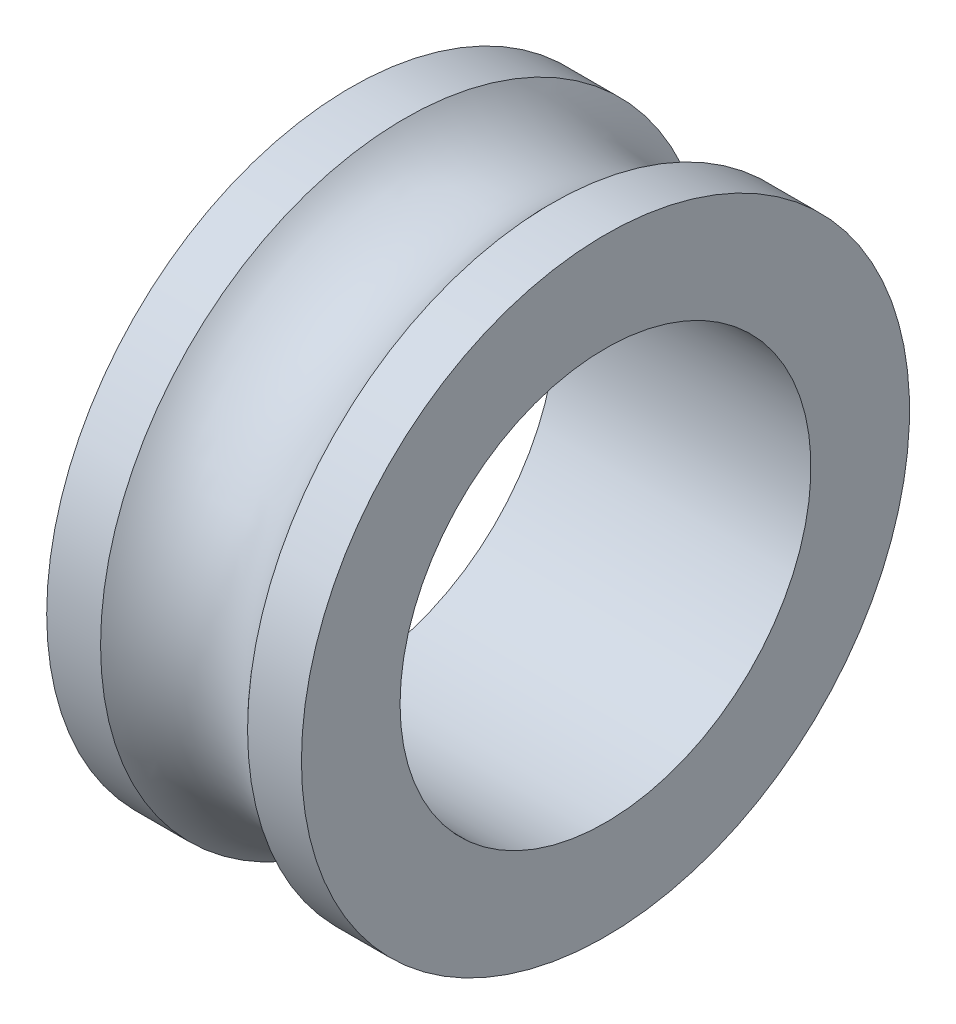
SolidWorks part; units mm, degrees
ref_plane "Front Plane" through (0, 0, 0) normal (0, 0, 1) x (1, 0, 0)
ref_plane "Top Plane" through (0, 0, 0) normal (0, 1, 0) x (1, 0, 0)
ref_plane "Right Plane" through (0, 0, 0) normal (1, 0, 0) x (0, 0, -1)
sketch "Sketch1" plane through (0, 0, 0) normal (0, 0, 1) x (1, 0, 0)
  line L0 (-14.4204, 0) -> (44.8035, 0) construction
  line L1 (0, 25) -> (0, 0) construction
  line L2 (-15.5, 25) -> (15.5, 25)
  line L3 (-15.5, 25) -> (-15.5, 37)
  line L4 (-15.5, 37) -> (-8.9443, 37)
  line L5 (15.5, 25) -> (15.5, 37)
  line L6 (-15.5, 25) -> (15.5, 37) construction
  line L7 (-15.5, 37) -> (15.5, 25) construction
  line L8 (8.9443, 37) -> (15.5, 37)
  arc A0 (-8.9443, 37) -> (8.9443, 37) centre (0, 45) ccw
  point P3 (0, 31)
  dimension "D5" = 12
  dimension "D1" = 31
  dimension "D2" = 25
  dimension "D3" = 37
  dimension "D4" = 8
revolve "Revolve1" add sketch "Sketch1" angle 360 about L0
